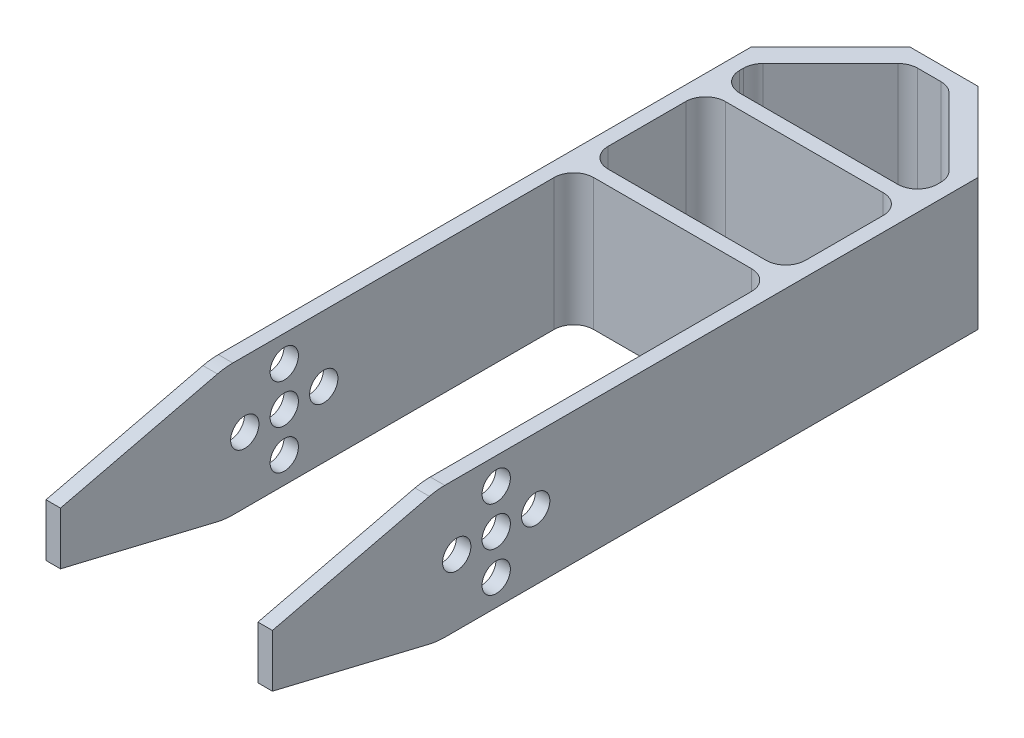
SolidWorks part; units mm, degrees
ref_plane "Front Plane" through (0, 0, 0) normal (0, 0, 1) x (1, 0, 0)
ref_plane "Top Plane" through (0, 0, 0) normal (0, 1, 0) x (1, 0, 0)
ref_plane "Right Plane" through (0, 0, 0) normal (1, 0, 0) x (0, 0, -1)
sketch "Sketch1" plane through (0, 0, 0) normal (0, 1, 0) x (1, 0, 0)
  line L0 (0, 107.2) -> (12, 119.2)
  line L1 (0, 0) -> (2.2, 0)
  line L2 (0, 0) -> (0, 107.2)
  line L3 (12, 119.2) -> (22.4, 119.2)
  line L4 (34.4, 0) -> (34.4, 107.2)
  line L5 (12, 119.2) -> (22.4, 119.2)
  line L6 (22.4, 119.2) -> (34.4, 107.2)
  line L7 (32.2, 0) -> (34.4, 0)
  line L8 (15.4423, 117) -> (18.9577, 117)
  line L9 (2.2, 0) -> (2.2, 75)
  line L10 (5.2, 78) -> (29.2, 78)
  line L11 (32.2, 0) -> (32.2, 75)
  line L12 (5.2, 98) -> (29.2, 98)
  line L13 (2.2, 95) -> (2.2, 83.2)
  line L14 (5.2, 80.2) -> (29.2, 80.2)
  line L15 (32.2, 95) -> (32.2, 83.2)
  line L16 (5.2, 100.2) -> (29.2, 100.2)
  line L17 (3.0785, 105.8789) -> (13.3209, 116.1213)
  line L18 (21.0791, 116.1213) -> (31.3215, 105.8789)
  line L19 (2.2, 103.1992) -> (2.1999, 103.7568)
  line L20 (32.2, 103.1992) -> (32.2001, 103.7568)
  line L21 (2.2002, 98) -> (32.2002, 98) construction
  line L22 (20.2002, 117.0002) -> (32.2002, 105.0002) construction
  line L23 (2.2002, 100.2) -> (32.2002, 100.2) construction
  line L24 (2.1998, 105.0002) -> (14.1998, 117.0002) construction
  line L25 (12, 117) -> (22.4, 117) construction
  arc A0 (2.2, 75) -> (5.2, 78) centre (5.2, 75) cw
  arc A1 (29.2, 78) -> (32.2, 75) centre (29.2, 75) cw
  arc A2 (29.2, 80.2) -> (32.2, 83.2) centre (29.2, 83.2) ccw
  arc A3 (2.2, 83.2) -> (5.2, 80.2) centre (5.2, 83.2) ccw
  arc A4 (5.2, 98) -> (2.2, 95) centre (5.2, 95) ccw
  arc A5 (29.2, 98) -> (32.2, 95) centre (29.2, 95) cw
  arc A6 (31.3215, 105.8789) -> (32.2001, 103.7568) centre (29.2001, 103.7576) cw
  arc A7 (29.2, 100.2) -> (32.2, 103.1992) centre (29.2, 103.2) ccw
  arc A8 (3.0785, 105.8789) -> (2.1999, 103.7568) centre (5.1999, 103.7576) ccw
  arc A9 (5.2, 100.2) -> (2.2, 103.1992) centre (5.2, 103.2) cw
  arc A10 (15.4423, 117) -> (13.3209, 116.1213) centre (15.4423, 114) ccw
  arc A11 (21.0791, 116.1213) -> (18.9577, 117) centre (18.9577, 114) ccw
extrude "Boss-Extrude1" add sketch "Sketch1" along normal mid plane 20 contours L10 A1 L11 L7 L4 L6 L3 L0 L2 L1 L9 A0 A11 L18 A6 L20 A7 L16 A9 L19 A8 L17 A10 L8 L12 A5 L15 A2 L14 A3 L13 A4
sketch "Sketch2" plane through (34.4, 0, 0) normal (1, 0, 0) x (0, 0, -1)
  line L0 (0, 10) -> (0, -10) construction
  line L3 (0, 10) -> (0, 4)
  line L5 (107.2, 10) -> (107.2, -10) construction
  line L6 (0, 4) -> (23.8495, 9.7239)
  line L7 (0, -4) -> (23.8495, -9.7239)
  line L8 (0, -4) -> (0, -10)
  line L9 (26.1832, 10) -> (0, 10)
  line L10 (26.1832, -10) -> (0, -10)
  arc A0 (23.8495, 9.7239) -> (26.1832, 10) centre (26.1832, 0) cw
  arc A1 (26.1832, -10) -> (23.8495, -9.7239) centre (26.1832, 0) cw
  circle A2 centre (34, 0) radius 2.15
  circle A3 centre (34, -6) radius 2.15
  circle A4 centre (34, 6) radius 2.15
  circle A5 centre (28, 0) radius 2.15
  circle A6 centre (40, 0) radius 2.15
  dimension "D1" = 10
  dimension "D2" = 10
  dimension "D5" = 26.1832
  dimension "D14" = 4.3
  dimension "D3" = 24.5267
  dimension "D4" = 24.5267
  dimension "D6" = 26.1832
  dimension "D7" = 6
  dimension "D8" = 6
  dimension "D9" = 73.2
  dimension "D10" = 6
  dimension "D11" = 6
  dimension "D12" = 6
  dimension "D13" = 6
extrude "Cut-Extrude1" cut sketch "Sketch2" against normal through all
equation "\"D8@Sketch1\"=\"D7@Sketch1\""
equation "\"D10@Sketch1\"=\"D7@Sketch1\""
equation "\"D11@Sketch1\"=\"D7@Sketch1\""
equation "\"D12@Sketch1\"=\"D7@Sketch1\""
